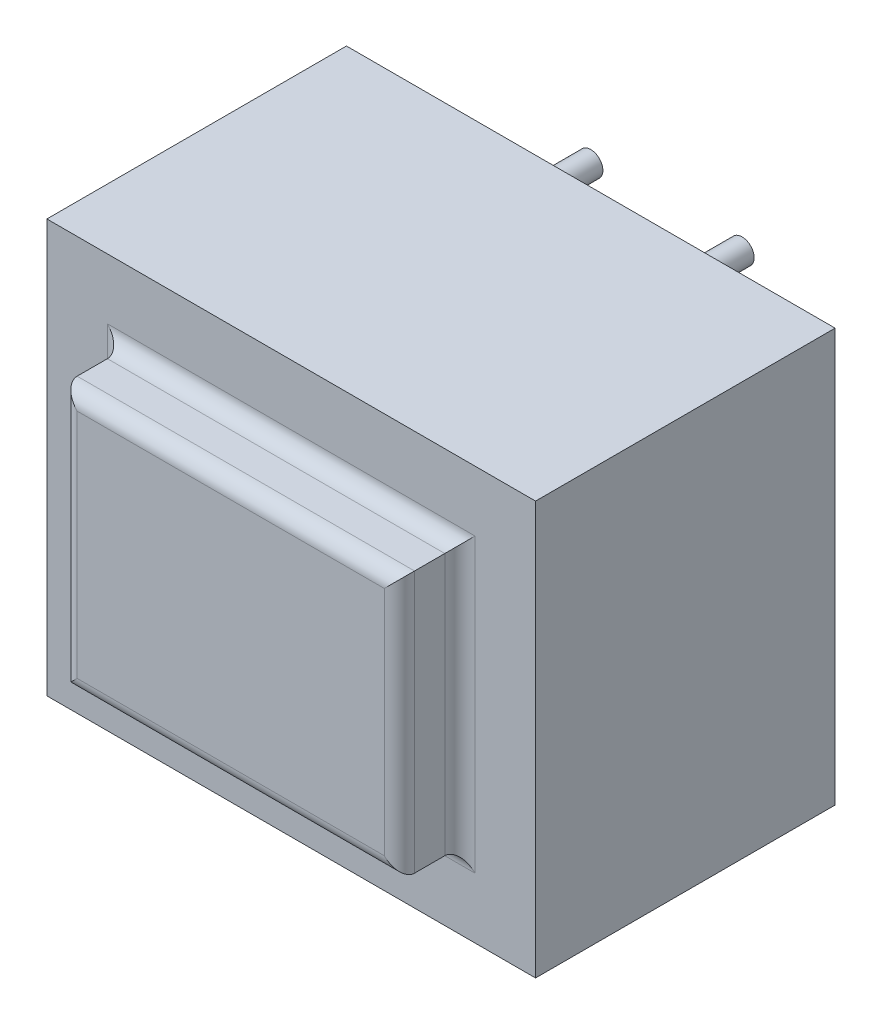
SolidWorks part; units mm, degrees
ref_plane "Front Plane" through (0, 0, 0) normal (0, 0, 1) x (1, 0, 0)
ref_plane "Top Plane" through (0, 0, 0) normal (0, 1, 0) x (1, 0, 0)
ref_plane "Right Plane" through (0, 0, 0) normal (1, 0, 0) x (0, 0, -1)
sketch "Sketch1" plane through (0, 0, 0) normal (0, 0, 1) x (1, 0, 0)
  line L1 (0, 0) -> (32.3, 0)
  line L2 (0, 0) -> (0, 27.3)
  line L3 (0, 27.3) -> (32.3, 27.3)
  line L4 (32.3, 0) -> (32.3, 27.3)
  dimension "D1" = 32.3
  dimension "D2" = 27.3
extrude "Boss-Extrude1" add sketch "Sketch1" along normal blind 19.8
sketch "Sketch2" plane through (0, 0, 19.8) normal (0, 0, 1) x (1, 0, 0)
  line L0 (0, 27.3) -> (0, 0) construction
  line L1 (5, 22.3) -> (27.3, 22.3)
  line L2 (5, 22.3) -> (5, 5)
  line L3 (5, 5) -> (27.3, 5)
  line L4 (27.3, 22.3) -> (27.3, 5)
  line L5 (32.3, 27.3) -> (0, 27.3) construction
  line L6 (32.3, 0) -> (32.3, 27.3) construction
  line L7 (0, 0) -> (32.3, 0) construction
  point P10 (16.15, 0)
  dimension "D1" = 5
  dimension "D2" = 5
  dimension "D3" = 5
  dimension "D4" = 5
extrude "Boss-Extrude2" add sketch "Sketch2" along normal blind 4
sketch "Sketch4" plane through (0, 0, 0) normal (0, 0, -1) x (-1, 0, 0)
  line L0 (-32.3, 27.3) -> (0, 27.3) construction
  line L1 (0, 0) -> (-32.3, 0) construction
  line L4 (-32.3, 0) -> (-32.3, 27.3) construction
  line L5 (0, 27.3) -> (0, 0) construction
  circle A0 centre (-6.15, 3.65) radius 0.8
  circle A1 centre (-26.15, 3.65) radius 0.8
  circle A2 centre (-11.15, 23.65) radius 0.8
  circle A3 centre (-21.15, 23.65) radius 0.8
  dimension "D1" = 2
  dimension "D6" = 6.15
  dimension "D2" = 10
  dimension "D3" = 11.15
  dimension "D4" = 20
  dimension "D7" = 11.15
  dimension "D8" = 6.15
  dimension "D9" = 3.65
  dimension "D10" = 3.65
  dimension "D5" = 2
extrude "Boss-Extrude3" add sketch "Sketch4" along normal blind 5
fillet "Fillet1" radius 1 8 edges at (5, 13.65, 23.8) (16.15, 5, 23.8) (16.15, 22.3, 23.8) (27.3, 13.65, 23.8) (27.3, 13.65, 19.8) (16.15, 22.3, 19.8) (5, 13.65, 19.8) (16.15, 5, 19.8)
equation "\"A\"= 32.3mm"
equation "\"B\"= 27.3mm"
equation "\"C\"= 23.8mm"
equation "\"D\"= 20mm"
equation "\"E\"= 20mm"
equation "\"F\"= 10mm"
equation "\"H\"= 5mm"
equation "\"D2@Sketch4\"=\"F\""
equation "\"D3@Sketch4\"=(\"A\"-\"F\")/2"
equation "\"D6@Sketch4\"=(\"A\"-\"D\")/2"
equation "\"D2@Sketch1\"=\"B\""
equation "\"D1@Sketch1\"=\"A\""
equation "\"D1@Boss-Extrude1\"=\"C\"-4"
equation "\"D4@Sketch4\"=\"D\""
equation "\"D9@Sketch4\"=(\"B\"-\"E\")/2"
equation "\"D10@Sketch4\"=(\"B\"-\"E\")/2"
